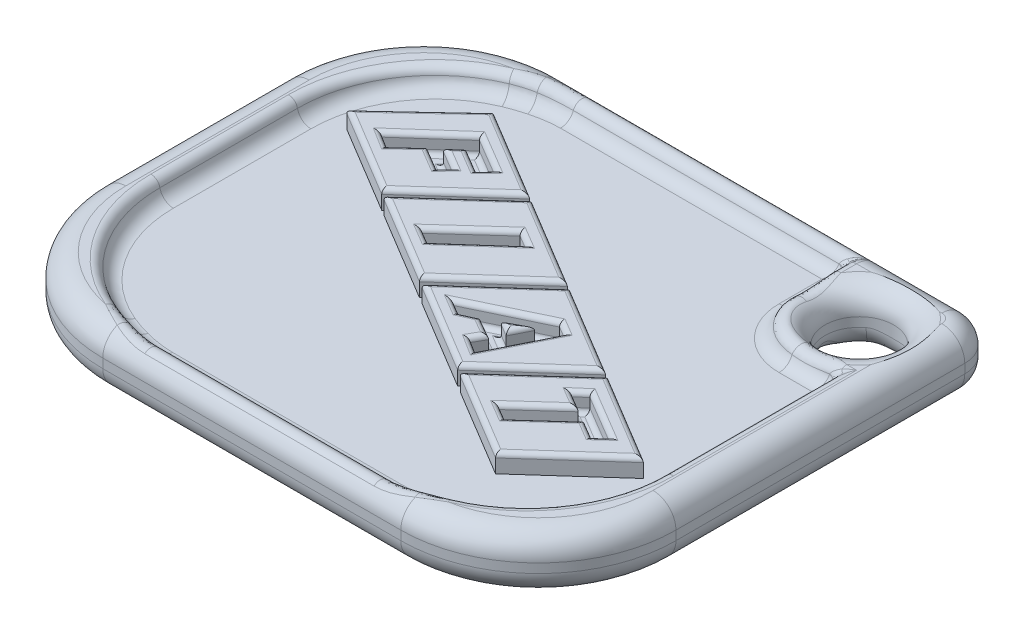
SolidWorks part; units mm, degrees
ref_plane "Ön Düzlem" through (0, 0, 0) normal (0, 0, 1) x (1, 0, 0)
ref_plane "Üst Düzlem" through (0, 0, 0) normal (0, 1, 0) x (1, 0, 0)
ref_plane "Sağ Düzlem" through (0, 0, 0) normal (1, 0, 0) x (0, 0, -1)
sketch "Çizim1" plane through (0, 0, 0) normal (0, 1, 0) x (1, 0, 0)
  line L1 (-41.6667, 37.8333) -> (53.3333, 37.8333)
  line L2 (-71.6667, 7.8333) -> (-71.6667, -32.1667)
  line L3 (-41.6667, -62.1667) -> (23.3333, -62.1667)
  line L4 (53.3333, 37.8333) -> (53.3333, -32.1667)
  arc A0 (23.3333, -62.1667) -> (53.3333, -32.1667) centre (23.3333, -32.1667) ccw
  arc A1 (-71.6667, -32.1667) -> (-41.6667, -62.1667) centre (-41.6667, -32.1667) ccw
  arc A2 (-41.6667, 37.8333) -> (-71.6667, 7.8333) centre (-41.6667, 7.8333) ccw
  circle A3 centre (38.3333, 22.8333) radius 7.5
  point P8 (-71.6667, -62.1667)
  point P11 (-71.6667, 37.8333)
  dimension "D3" = 30
  dimension "D4" = 15
  dimension "D1" = 100
  dimension "D2" = 125
  dimension "D5" = 15
extrude "Yükseklik-Ekstrüzyon1" add sketch "Çizim1" along normal blind 12
sketch "Çizim2" plane through (0, 12, 0) normal (0, 1, 0) x (1, 0, 0)
  line L0 (53.3333, 37.8333) -> (-41.6667, 37.8333) construction
  line L1 (-34.1667, 32.8333) -> (25.8333, 32.8333)
  line L2 (-64.1667, 2.8333) -> (-64.1667, -27.1667)
  line L3 (-34.1667, -57.1667) -> (15.8333, -57.1667)
  line L4 (45.8333, 10.8333) -> (45.8333, -27.1667)
  line L5 (-71.6667, 7.8333) -> (-71.6667, -32.1667) construction
  line L8 (25.8333, 32.8333) -> (25.8333, 20.8333)
  line L9 (35.8333, 10.8333) -> (45.8333, 10.8333)
  arc A0 (15.8333, -57.1667) -> (45.8333, -27.1667) centre (15.8333, -27.1667) ccw
  arc A1 (-64.1667, -27.1667) -> (-34.1667, -57.1667) centre (-34.1667, -27.1667) ccw
  arc A2 (-34.1667, 32.8333) -> (-64.1667, 2.8333) centre (-34.1667, 2.8333) ccw
  arc A3 (25.8333, 20.8333) -> (35.8333, 10.8333) centre (35.8333, 20.8333) ccw
  point P8 (-64.1667, -57.1667)
  point P11 (-64.1667, 32.8333)
  dimension "D3" = 30
  dimension "D8" = 10
  dimension "D1" = 90
  dimension "D2" = 110
  dimension "D4" = 5
  dimension "D5" = 7.5
extrude "Kes-Ekstrüzyon1" cut sketch "Çizim2" against normal blind 4
sketch "Çizim3" plane through (0, 0, 0) normal (0, -1, 0) x (1, 0, 0)
  line L0 (-41.6667, 62.1667) -> (23.3333, 62.1667) construction
  line L1 (-34.1667, 57.1667) -> (15.8333, 57.1667)
  line L2 (-64.1667, 27.1667) -> (-64.1667, -2.8333)
  line L3 (-34.1667, -32.8333) -> (25.8333, -32.8333)
  line L4 (45.8333, 27.1667) -> (45.8333, -10.8333)
  line L6 (-71.6667, -7.8333) -> (-71.6667, 32.1667) construction
  line L11 (25.8333, -32.8333) -> (25.8333, -20.8333)
  line L12 (35.8333, -10.8333) -> (45.8333, -10.8333)
  arc A0 (25.8333, -20.8333) -> (35.8333, -10.8333) centre (35.8333, -20.8333) cw
  arc A1 (-64.1667, -2.8333) -> (-34.1667, -32.8333) centre (-34.1667, -2.8333) ccw
  arc A2 (-34.1667, 57.1667) -> (-64.1667, 27.1667) centre (-34.1667, 27.1667) ccw
  arc A3 (15.8333, 57.1667) -> (45.8333, 27.1667) centre (15.8333, 27.1667) cw
  point P14 (25.8333, -10.8333)
  point P15 (-64.1667, -32.8333)
  point P18 (-64.1667, 57.1667)
  dimension "D7" = 10
  dimension "D1" = 30
  dimension "D2" = 90
  dimension "D3" = 5
  dimension "D4" = 7.5
  dimension "D5" = 22
  dimension "D6" = 20
extrude "Kes-Ekstrüzyon2" cut sketch "Çizim3" against normal blind 4
fillet "Radyus11" radius 5 15 edges at (5.8333, 12, -37.8333) (53.3333, 12, -2.8333) (44.5465, 12, 53.3799) (-9.1667, 12, 62.1667) (-62.8799, 12, 53.3799) (-71.6667, 12, 12.1667) (5.8333, 0, -37.8333) (53.3333, 0, -2.8333) (44.5465, 0, 53.3799) (-9.1667, 0, 62.1667) (-62.8799, 0, 53.3799) (-71.6667, 0, 12.1667) (38.3333, 12, -15.3333) (-62.8799, 12, -29.0465) (-62.8799, 0, -29.0465)
fillet "Radyus12" radius 5 1 edges at (38.3333, 0, -15.3333)
fillet "Radyus13" radius 3 10 edges at (-64.1667, 4, 12.1667) (-55.3799, 4, 48.3799) (-9.1667, 4, 57.1667) (37.0465, 4, 48.3799) (45.8333, 4, 8.1667) (40.8333, 4, -10.8333) (28.7623, 4, -13.7623) (25.8333, 4, -26.8333) (-4.1667, 4, -32.8333) (-55.3799, 4, -24.0465)
fillet "Radyus14" radius 3 2 edges at (25.8333, 0, -27.8333) (38.8331, 0.024, -10.8333)
fillet "Radyus15" radius 3 4 edges at (27.2654, 0.2614, -32.8333) (45.8333, 0.3856, -12.0869) (24.5654, 3.4495, -31.5654) (44.5447, 3.464, -9.5447)
fillet "Radyus18" radius 2 7 edges at (-55.3799, 12, -24.0465) (-64.1667, 12, 12.1667) (-9.1667, 12, 57.1667) (37.0465, 12, 48.3799) (-55.3799, 12, 48.3799) (-4.1667, 12, -32.8333) (45.8333, 12, 8.1667)
fillet "Radyus19" radius 7 3 edges at (51.8689, 1.4645, -36.3689) (51.8689, 10.5355, -36.3689) (53.3333, 6, -37.8333)
fillet "Radyus20" radius 3 10 edges at (40.8333, 8, -10.8333) (25.8333, 8, -26.8333) (-4.1667, 8, -32.8333) (45.8333, 8, 8.1667) (37.0465, 8, 48.3799) (-9.1667, 8, 57.1667) (-55.3799, 8, 48.3799) (-64.1667, 8, 12.1667) (28.7623, 8, -13.7623) (-55.3799, 8, -24.0465)
fillet "Radyus23" radius 2 6 edges at (44.8333, 12, -10.8333) (38.8333, 11.976, -10.8333) (25.8333, 12, -21.8333) (25.8333, 11.6709, -34.6174) (25.8333, 12, -27.8333)
fillet "Radyus24" radius 2 5 edges at (24.5399, 8.5327, -31.8614) (44.8317, 8.6762, -9.7307) (26.2034, 11.1204, -34.163) (46.5684, 11.5492, -11.4674)
sketch "Çizim4" plane through (0, 8, 0) normal (0, 1, 0) x (1, 0, 0)
  line L0 (339.9005, 20.349) -> (1482.7902, -666.3684) construction
  line L1 (-57.218, 6.6165) -> (-38.1572, -4.8357)
  line L2 (24.0362, -42.2027) -> (41.0369, -26.9728)
  line L3 (41.0369, -26.9728) -> (21.7573, -15.3893)
  line L4 (-40.6558, 22.1098) -> (-57.218, 6.6165)
  line L5 (-21.1564, 10.3942) -> (-38.1572, -4.8357)
  line L6 (-19.8636, 9.6175) -> (-36.8644, -5.6124)
  line L7 (-0.5282, -1.9997) -> (-17.529, -17.2295)
  line L8 (-16.0699, -18.1062) -> (0.9309, -2.8763)
  line L9 (3.3318, -29.7631) -> (20.3326, -14.5332)
  line L10 (21.7573, -15.3893) -> (4.7566, -30.6191)
  line L11 (4.7566, -30.6191) -> (24.0362, -42.2027)
  line L12 (20.3326, -14.5332) -> (0.9309, -2.8763)
  line L13 (-0.5282, -1.9997) -> (-19.8636, 9.6175)
  line L14 (-16.0699, -18.1062) -> (3.3318, -29.7631)
  line L15 (-36.8644, -5.6124) -> (-17.529, -17.2295)
  line L16 (-21.1564, 10.3942) -> (-40.6558, 22.1098)
  line L17 (-48.9939, 5.9505) -> (-45.895, 4.0163)
  line L18 (-45.895, 4.0163) -> (-41.3194, 8.2591)
  line L19 (-41.3194, 8.2591) -> (-36.2031, 5.2225)
  line L20 (-36.2031, 5.2225) -> (-34.5185, 6.9904)
  line L21 (-34.5185, 6.9904) -> (-39.4017, 9.8885)
  line L22 (-39.4017, 9.8885) -> (-36.723, 12.1899)
  line L23 (-36.723, 12.1899) -> (-31.4967, 9.0881)
  line L24 (-31.4967, 9.0881) -> (-29.5201, 11.1623)
  line L25 (-29.5201, 11.1623) -> (-37.6687, 15.9985)
  line L26 (-37.6687, 15.9985) -> (-48.9939, 5.9505)
  line L27 (-26.4232, -7.8054) -> (-23.3682, -9.6186)
  line L28 (-23.3682, -9.6186) -> (-11.9964, 0.4709)
  line L29 (-11.9964, 0.4709) -> (-15.1882, 2.3652)
  line L30 (-15.1882, 2.3652) -> (-26.4232, -7.8054)
  line L31 (-0.5282, -23.1865) -> (0.9309, -20.6312)
  line L32 (0.9309, -20.6312) -> (-3.3191, -18.2044)
  line L33 (-3.3191, -18.2044) -> (-6.5392, -19.6722)
  line L34 (-6.5392, -19.6722) -> (-9.3321, -18.0146)
  line L35 (-9.3321, -18.0146) -> (6.2963, -10.5108)
  line L36 (6.2963, -10.5108) -> (8.9262, -12.0716)
  line L37 (8.9262, -12.0716) -> (2.4527, -25.0647)
  line L38 (2.4527, -25.0647) -> (-0.5282, -23.1865)
  line L39 (-0.4672, -16.451) -> (2.1675, -18.0146)
  line L40 (2.1675, -18.0146) -> (4.2303, -13.8742)
  line L41 (4.2303, -13.8742) -> (-0.4672, -16.451)
  line L42 (15.2682, -32.7023) -> (18.3731, -34.5451)
  line L43 (18.3731, -34.5451) -> (27.4722, -26.308)
  line L44 (27.4722, -26.308) -> (31.3458, -28.607)
  line L45 (31.3458, -28.607) -> (33.4106, -26.7378)
  line L46 (33.4106, -26.7378) -> (22.9226, -20.5133)
  line L47 (22.9226, -20.5133) -> (20.7717, -22.3612)
  line L48 (20.7717, -22.3612) -> (24.3454, -24.4822)
  line L49 (24.3454, -24.4822) -> (15.2682, -32.7023)
  line L50 (15.2682, -32.7023) -> (15.2759, -32.7087)
extrude "Yükseklik-Ekstrüzyon3" add sketch "Çizim4" along normal blind 4
fillet "Radyus25" radius 1 82 edges at (3.1989, 12, 15.9444) (0.8501, 12, 17.2328) (1.8816, 12, 15.1626) (31.3971, 12, 21.1811) (32.5366, 12, 34.5878) (14.3964, 12, 36.4109) (13.257, 12, 23.0042) (16.8206, 12, 33.6237) (22.9226, 12, 30.4265) (29.409, 12, 27.4575) (32.3782, 12, 27.6724) (28.1666, 12, 23.6255) (21.8472, 12, 21.4372) (22.5585, 12, 23.4217) (19.8068, 12, 28.5922) (22.5585, 8, 23.4217) (21.8472, 8, 21.4372) (28.1666, 8, 23.6255) (32.3782, 8, 27.6724) (29.409, 8, 27.4575) (22.9226, 8, 30.4265) (16.8206, 8, 33.6237) (19.8068, 8, 28.5922) (7.6113, 12, 11.2912) (-1.5179, 12, 14.2627) (-7.9356, 12, 18.8434) (-4.9291, 12, 18.9383) (-1.1941, 12, 19.4178) (0.2014, 12, 21.9089) (0.9623, 12, 24.1256) (5.6895, 12, 18.5682) (10.6318, 12, 8.7048) (11.8322, 12, 22.1482) (-6.369, 12, 23.9346) (-7.5695, 12, 10.4913) (3.1989, 8, 15.9444) (1.8816, 8, 15.1626) (0.8501, 8, 17.2328) (0.2014, 8, 21.9089) (-1.1941, 8, 19.4178) (-4.9291, 8, 18.9383) (-7.9356, 8, 18.8434) (-1.5179, 8, 14.2627) (7.6113, 8, 11.2912) (5.6895, 8, 18.5682) (0.9623, 8, 24.1256) (-13.5923, 8, -1.4181) (-17.6823, 8, 4.5738) (-24.8957, 8, 8.712) (-20.8057, 8, 2.7201) (-10.1959, 12, -3.8089) (-9.0286, 12, 9.6146) (-27.1967, 12, 11.421) (-28.364, 12, -2.0025) (-24.8957, 12, 8.712) (-17.6823, 12, 4.5738) (-13.5923, 12, -1.4181) (-20.8057, 12, 2.7201) (-47.6876, 12, -0.8904) (-48.9369, 12, -14.3632) (-30.9061, 12, -16.252) (-29.6568, 12, -2.7793) (-47.4444, 12, -4.9834) (-43.6072, 12, -6.1377) (-38.7612, 12, -6.7408) (-35.3608, 12, -6.1065) (-36.9601, 12, -8.4395) (-38.0624, 12, -11.0392) (-34.1099, 12, -10.639) (-30.5084, 12, -10.1252) (-33.5944, 12, -13.5804) (-43.3313, 12, -10.9745) (-33.5944, 8, -13.5804) (-30.5084, 8, -10.1252) (-34.1099, 8, -10.639) (-38.0624, 8, -11.0392) (-36.9601, 8, -8.4395) (-35.3608, 8, -6.1065) (-38.7612, 8, -6.7408) (-43.6072, 8, -6.1377) (-47.4444, 8, -4.9834) (-43.3313, 8, -10.9745)
